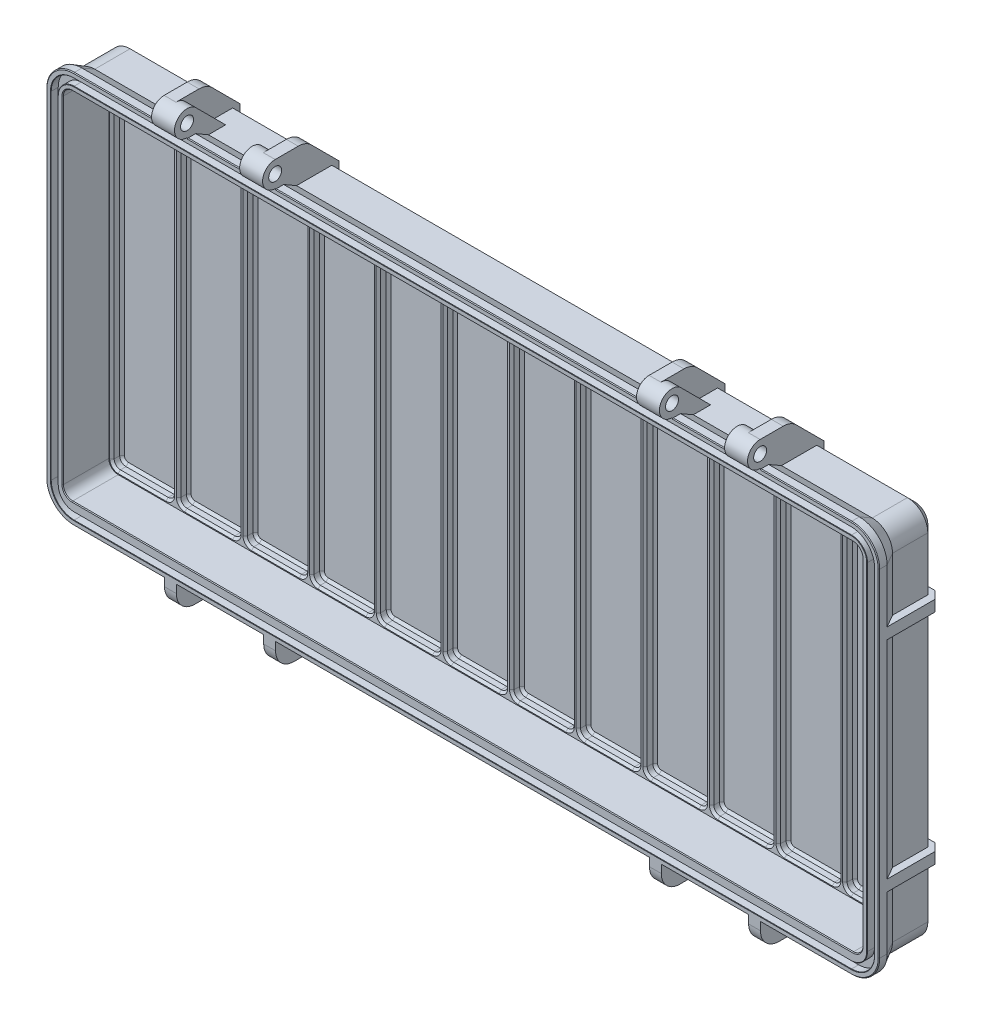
SolidWorks part; units mm, degrees
ref_plane "Front Plane" through (0, 0, 0) normal (0, 0, 1) x (1, 0, 0)
ref_plane "Top Plane" through (0, 0, 0) normal (0, 1, 0) x (1, 0, 0)
ref_plane "Right Plane" through (0, 0, 0) normal (1, 0, 0) x (0, 0, -1)
ref_plane "Bottom plane" through (0, 0, -2) normal (0, 0, 1) x (1, 0, 0)
sketch "Sketch1" plane through (0, 0, 0) normal (0, 0, 1) x (1, 0, 0)
  line L1 (-9, 48) -> (9, 48)
  line L2 (-9, 48) -> (-9, -48)
  line L3 (-9, -48) -> (9, -48)
  line L4 (9, 48) -> (9, -48)
  line L5 (-9, 48) -> (9, -48) construction
  line L6 (-9, -48) -> (9, 48) construction
  point P0 (0, 0)
  dimension "D1" = 18
  dimension "D2" = 96
extrude "Boss-Extrude1" add sketch "Sketch1" along normal blind 2.75
sketch "Sketch2" plane through (0, 0, 0) normal (0, 0, 1) x (1, 0, 0)
  line L1 (-6.45, 46.5) -> (6.45, 46.5)
  line L2 (-7.5, 45.45) -> (-7.5, -45.45)
  line L3 (-6.45, -46.5) -> (6.45, -46.5)
  line L4 (7.5, 45.45) -> (7.5, -45.45)
  line L5 (-7.5, 46.5) -> (7.5, -46.5) construction
  line L6 (-7.5, -46.5) -> (7.5, 46.5) construction
  arc A0 (-7.5, -45.45) -> (-6.45, -46.5) centre (-6.45, -45.45) ccw
  arc A1 (6.45, -46.5) -> (7.5, -45.45) centre (6.45, -45.45) ccw
  arc A2 (6.45, 46.5) -> (7.5, 45.45) centre (6.45, 45.45) cw
  arc A3 (-6.45, 46.5) -> (-7.5, 45.45) centre (-6.45, 45.45) ccw
  point P0 (0, 0)
  dimension "D3" = 1.05
  dimension "D1" = 15
  dimension "D2" = 93
extrude "Cut-Extrude1" cut sketch "Sketch2" along normal blind 0.65 draft 45
sketch "Sketch4" plane through (0, 0, 0.65) normal (0, 0, -1) x (-1, 0, 0)
  line L4 (8.15, -45.45) -> (8.15, 45.45)
  line L5 (6.45, 47.15) -> (-6.45, 47.15)
  line L6 (-8.15, 45.45) -> (-8.15, -45.45)
  line L7 (-6.45, -47.15) -> (6.45, -47.15)
  line L8 (8.15, -45.45) -> (8.15, 45.45)
  line L9 (6.45, 47.15) -> (-6.45, 47.15)
  line L10 (-8.15, 45.45) -> (-8.15, -45.45)
  line L11 (-6.45, -47.15) -> (6.45, -47.15)
  arc A4 (6.45, -47.15) -> (8.15, -45.45) centre (6.45, -45.45) ccw
  arc A5 (8.15, 45.45) -> (6.45, 47.15) centre (6.45, 45.45) ccw
  arc A6 (-6.45, 47.15) -> (-8.15, 45.45) centre (-6.45, 45.45) ccw
  arc A7 (-8.15, -45.45) -> (-6.45, -47.15) centre (-6.45, -45.45) ccw
  arc A8 (6.45, -47.15) -> (8.15, -45.45) centre (6.45, -45.45) ccw
  arc A9 (8.15, 45.45) -> (6.45, 47.15) centre (6.45, 45.45) ccw
  arc A10 (-6.45, 47.15) -> (-8.15, 45.45) centre (-6.45, 45.45) ccw
  arc A11 (-8.15, -45.45) -> (-6.45, -47.15) centre (-6.45, -45.45) ccw
  dimension "D1" = 0
extrude "Cut-Extrude2" cut sketch "Sketch4" against normal blind 1.5
sketch "Sketch5" plane through (0, 0, 2.15) normal (0, 0, -1) x (-1, 0, 0)
  line L4 (8.15, -45.45) -> (8.15, 45.45)
  line L5 (6.45, 47.15) -> (-6.45, 47.15)
  line L6 (-8.15, 45.45) -> (-8.15, -45.45)
  line L7 (-6.45, -47.15) -> (6.45, -47.15)
  line L8 (8.15, -45.45) -> (8.15, 45.45)
  line L9 (6.45, 47.15) -> (-6.45, 47.15)
  line L10 (-8.15, 45.45) -> (-8.15, -45.45)
  line L11 (-6.45, -47.15) -> (6.45, -47.15)
  arc A4 (6.45, -47.15) -> (8.15, -45.45) centre (6.45, -45.45) ccw
  arc A5 (8.15, 45.45) -> (6.45, 47.15) centre (6.45, 45.45) ccw
  arc A6 (-6.45, 47.15) -> (-8.15, 45.45) centre (-6.45, 45.45) ccw
  arc A7 (-8.15, -45.45) -> (-6.45, -47.15) centre (-6.45, -45.45) ccw
  arc A8 (6.45, -47.15) -> (8.15, -45.45) centre (6.45, -45.45) ccw
  arc A9 (8.15, 45.45) -> (6.45, 47.15) centre (6.45, 45.45) ccw
  arc A10 (-6.45, 47.15) -> (-8.15, 45.45) centre (-6.45, 45.45) ccw
  arc A11 (-8.15, -45.45) -> (-6.45, -47.15) centre (-6.45, -45.45) ccw
  dimension "D1" = 0
extrude "Cut-Extrude3" cut sketch "Sketch5" against normal blind 0.85 draft 45
pattern_linear "LPattern1" count 12 spacing 18 along (1, 0, 0) of "Boss-Extrude1", "Cut-Extrude1", "Cut-Extrude2", "Cut-Extrude3"
sketch "Sketch6" plane through (0, 0, 0) normal (0, 0, -1) x (-1, 0, 0)
  line L2 (9, -51.5) -> (-207, -51.5)
  line L4 (6, -51.5) -> (-204, -51.5)
  line L8 (11.5, 50.5) -> (11.5, -48)
  line L9 (-209.5, -48) -> (-209.5, 50.5)
  line L10 (-209.5, 50.5) -> (11.5, 50.5)
  line L11 (11.5, 45) -> (11.5, -46)
  line L17 (-209.5, -46) -> (-209.5, 45)
  line L18 (-204, 50.5) -> (6, 50.5)
  arc A0 (11.5, 45) -> (6, 50.5) centre (6, 45) ccw
  arc A1 (6, -51.5) -> (11.5, -46) centre (6, -46) ccw
  arc A2 (-209.5, -46) -> (-204, -51.5) centre (-204, -46) ccw
  arc A3 (-209.5, 45) -> (-204, 50.5) centre (-204, 45) cw
  dimension "D2" = 3.5
  dimension "D3" = 5.5
  dimension "D1" = 2.5
extrude "Boss-Extrude3" add sketch "Sketch6" along normal blind 2 draft 45
sketch "Sketch9" plane through (0, 0, 0) normal (0, 0, 1) x (1, 0, 0)
  line L0 (209.5, 45) -> (209.5, -46) construction
  line L1 (204, -51.5) -> (-6, -51.5) construction
  line L2 (-11.5, -46) -> (-11.5, 45) construction
  line L3 (-6, 50.5) -> (204, 50.5) construction
  line L4 (209.5, 45) -> (209.5, -46)
  line L5 (204, -51.5) -> (-6, -51.5)
  line L6 (-11.5, -46) -> (-11.5, 45)
  line L7 (-6, 50.5) -> (204, 50.5)
  line L8 (-9, -48) -> (207, -48) construction
  line L9 (207, -48) -> (207, 48) construction
  line L10 (-9, 48) -> (-9, -48) construction
  line L11 (207, 48) -> (-9, 48) construction
  line L12 (-6.45, -48) -> (204.45, -48)
  line L13 (207, -45.45) -> (207, 45.45)
  line L14 (-9, 45.45) -> (-9, -45.45)
  line L15 (204.45, 48) -> (-6.45, 48)
  arc A0 (209.5, 45) -> (204, 50.5) centre (204, 45) ccw construction
  arc A1 (204, -51.5) -> (209.5, -46) centre (204, -46) ccw construction
  arc A2 (-11.5, -46) -> (-6, -51.5) centre (-6, -46) ccw construction
  arc A3 (-6, 50.5) -> (-11.5, 45) centre (-6, 45) ccw construction
  arc A4 (209.5, 45) -> (204, 50.5) centre (204, 45) ccw
  arc A5 (204, -51.5) -> (209.5, -46) centre (204, -46) ccw
  arc A6 (-11.5, -46) -> (-6, -51.5) centre (-6, -46) ccw
  arc A7 (-6, 50.5) -> (-11.5, 45) centre (-6, 45) ccw
  arc A8 (204.45, -48) -> (207, -45.45) centre (204.45, -45.45) ccw
  arc A9 (-6.45, -48) -> (-9, -45.45) centre (-6.45, -45.45) cw
  arc A10 (207, 45.45) -> (204.45, 48) centre (204.45, 45.45) ccw
  arc A11 (-9, 45.45) -> (-6.45, 48) centre (-6.45, 45.45) cw
  dimension "D1" = 2.55
extrude "Boss-Extrude5" add sketch "Sketch9" along normal blind 13
sketch "Sketch10" plane through (0, 0, 13) normal (0, 0, 1) x (1, 0, 0)
  line L5 (204, 52.5) -> (-6, 52.5)
  line L6 (-13.5, 45) -> (-13.5, -46)
  line L7 (-6, -53.5) -> (204, -53.5)
  line L16 (211.5, -46) -> (211.5, 45)
  line L18 (204.45, -48) -> (-6.45, -48) construction
  line L19 (207, -45.45) -> (207, 45.45) construction
  line L20 (-9, 45.45) -> (-9, -45.45) construction
  line L21 (204.45, 48) -> (-6.45, 48) construction
  line L22 (204.45, -48) -> (-6.45, -48)
  line L23 (207, -45.45) -> (207, 45.45)
  line L24 (-9, 45.45) -> (-9, -45.45)
  line L25 (204.45, 48) -> (-6.45, 48)
  arc A4 (-6, 52.5) -> (-13.5, 45) centre (-6, 45) ccw
  arc A5 (-13.5, -46) -> (-6, -53.5) centre (-6, -46) ccw
  arc A6 (204, -53.5) -> (211.5, -46) centre (204, -46) ccw
  arc A7 (211.5, 45) -> (204, 52.5) centre (204, 45) ccw
  arc A16 (-9, -45.45) -> (-6.45, -48) centre (-6.45, -45.45) ccw construction
  arc A17 (204.45, -48) -> (207, -45.45) centre (204.45, -45.45) ccw construction
  arc A18 (207, 45.45) -> (204.45, 48) centre (204.45, 45.45) ccw construction
  arc A19 (-6.45, 48) -> (-9, 45.45) centre (-6.45, 45.45) ccw construction
  arc A20 (-9, -45.45) -> (-6.45, -48) centre (-6.45, -45.45) ccw
  arc A21 (204.45, -48) -> (207, -45.45) centre (204.45, -45.45) ccw
  arc A22 (207, 45.45) -> (204.45, 48) centre (204.45, 45.45) ccw
  arc A23 (-6.45, 48) -> (-9, 45.45) centre (-6.45, 45.45) ccw
extrude "Boss-Extrude6" add sketch "Sketch10" against normal blind 4 draft 30
sketch "Sketch11" plane through (0, 0, 13) normal (0, 0, 1) x (1, 0, 0)
  line L0 (-6.45, -48) -> (204.45, -48) construction
  line L1 (207, -45.45) -> (207, 45.45) construction
  line L2 (-9, 45.45) -> (-9, -45.45) construction
  line L3 (-6.45, 48) -> (204.45, 48) construction
  line L4 (204, 52.5) -> (-6, 52.5)
  line L5 (-13.5, 45) -> (-13.5, -46)
  line L6 (-6, -53.5) -> (204, -53.5)
  line L7 (211.5, -46) -> (211.5, 45)
  line L8 (204, 52.5) -> (-6, 52.5)
  line L9 (-13.5, 45) -> (-13.5, -46)
  line L10 (-6, -53.5) -> (204, -53.5)
  line L11 (211.5, -46) -> (211.5, 45)
  line L12 (-6.45, -48) -> (204.45, -48)
  line L13 (207, -45.45) -> (207, 45.45)
  line L14 (-9, 45.45) -> (-9, -45.45)
  line L15 (-6.45, 48) -> (204.45, 48)
  arc A0 (-9, -45.45) -> (-6.45, -48) centre (-6.45, -45.45) ccw construction
  arc A1 (204.45, -48) -> (207, -45.45) centre (204.45, -45.45) ccw construction
  arc A2 (207, 45.45) -> (204.45, 48) centre (204.45, 45.45) ccw construction
  arc A3 (-6.45, 48) -> (-9, 45.45) centre (-6.45, 45.45) ccw construction
  arc A4 (211.5, 45) -> (204, 52.5) centre (204, 45) ccw
  arc A5 (-6, 52.5) -> (-13.5, 45) centre (-6, 45) ccw
  arc A6 (-13.5, -46) -> (-6, -53.5) centre (-6, -46) ccw
  arc A7 (204, -53.5) -> (211.5, -46) centre (204, -46) ccw
  arc A8 (211.5, 45) -> (204, 52.5) centre (204, 45) ccw
  arc A9 (-6, 52.5) -> (-13.5, 45) centre (-6, 45) ccw
  arc A10 (-13.5, -46) -> (-6, -53.5) centre (-6, -46) ccw
  arc A11 (204, -53.5) -> (211.5, -46) centre (204, -46) ccw
  arc A12 (-9, -45.45) -> (-6.45, -48) centre (-6.45, -45.45) ccw
  arc A13 (204.45, -48) -> (207, -45.45) centre (204.45, -45.45) ccw
  arc A14 (207, 45.45) -> (204.45, 48) centre (204.45, 45.45) ccw
  arc A15 (-6.45, 48) -> (-9, 45.45) centre (-6.45, 45.45) ccw
  dimension "D1" = 0
extrude "Boss-Extrude7" add sketch "Sketch11" along normal blind 2.2
sketch "Sketch12" plane through (0, 0, 15.2) normal (0, 0, 1) x (1, 0, 0)
  line L28 (208.3, -46) -> (208.3, 45)
  line L29 (204, 49.3) -> (-6, 49.3)
  line L30 (-10.3, 45) -> (-10.3, -46)
  line L31 (-6, -50.3) -> (204, -50.3)
  line L32 (210.2, -46) -> (210.2, 45)
  line L33 (-6, -52.2) -> (204, -52.2)
  line L34 (-12.2, 45) -> (-12.2, -46)
  line L35 (204, 51.2) -> (-6, 51.2)
  line L36 (210.2, -46) -> (210.2, 45)
  line L37 (-6, -52.2) -> (204, -52.2)
  line L38 (-12.2, 45) -> (-12.2, -46)
  line L39 (204, 51.2) -> (-6, 51.2)
  line L40 (-9, 45.45) -> (-9, -45.45) construction
  arc A24 (208.3, 45) -> (204, 49.3) centre (204, 45) ccw
  arc A25 (-6, 49.3) -> (-10.3, 45) centre (-6, 45) ccw
  arc A26 (-10.3, -46) -> (-6, -50.3) centre (-6, -46) ccw
  arc A27 (204, -50.3) -> (208.3, -46) centre (204, -46) ccw
  arc A28 (210.2, 45) -> (204, 51.2) centre (204, 45) ccw
  arc A29 (204, -52.2) -> (210.2, -46) centre (204, -46) ccw
  arc A30 (-12.2, -46) -> (-6, -52.2) centre (-6, -46) ccw
  arc A31 (-6, 51.2) -> (-12.2, 45) centre (-6, 45) ccw
  arc A32 (210.2, 45) -> (204, 51.2) centre (204, 45) ccw
  arc A33 (204, -52.2) -> (210.2, -46) centre (204, -46) ccw
  arc A34 (-12.2, -46) -> (-6, -52.2) centre (-6, -46) ccw
  arc A35 (-6, 51.2) -> (-12.2, 45) centre (-6, 45) ccw
  dimension "D3" = 1.3
  dimension "D1" = 1.3
  dimension "D2" = 1.9
extrude "Cut-Extrude4" cut sketch "Sketch12" against normal blind 2
chamfer "Chamfer1" distance 0.2 16 edges at (207, 0, 15.2) (206.2531, 47.2531, 15.2) (206.2531, -47.2531, 15.2) (99, 48, 15.2) (99, -48, 15.2) (-8.2531, 47.2531, 15.2) (-8.2531, -47.2531, 15.2) (-9, 0, 15.2) (211.5, -0.5, 15.2) (209.3033, 50.3033, 15.2) (209.3033, -51.3033, 15.2) (99, 52.5, 15.2) (99, -53.5, 15.2) (-11.3033, 50.3033, 15.2) (-11.3033, -51.3033, 15.2) (-13.5, -0.5, 15.2)
chamfer "Chamfer2" distance 0.1 16 edges at (208.3, -0.5, 15.2) (207.0406, 48.0406, 15.2) (207.0406, -49.0406, 15.2) (99, 49.3, 15.2) (99, -50.3, 15.2) (-9.0406, 48.0406, 15.2) (-9.0406, -49.0406, 15.2) (-10.3, -0.5, 15.2) (210.2, -0.5, 15.2) (208.3841, 49.3841, 15.2) (208.3841, -50.3841, 15.2) (99, 51.2, 15.2) (99, -52.2, 15.2) (-10.3841, 49.3841, 15.2) (-10.3841, -50.3841, 15.2) (-12.2, -0.5, 15.2)
ref_plane "Plane 30mm" through (18.5, 0, 0) normal (-1, 0, 0) x (0, 0, 1)
ref_plane "Plane 45mm" through (33.5, 0, 0) normal (-1, 0, 0) x (0, 0, 1)
ref_plane "Plane 110.5mm" through (99, 0, 0) normal (-1, 0, 0) x (0, 0, 1)
sketch "Sketch14" plane through (18.5, 0, 0) normal (-1, 0, 0) x (0, 0, 1)
  line L0 (15, 52.5) -> (13, 52.5) construction
  line L2 (15.2, 45) -> (15.2, 52.3) construction
  line L3 (15.3, 52.7) -> (15.2, 52.6)
  line L4 (15, 52.5) -> (15.2, 52.3) construction
  line L5 (15, 52.5) -> (13, 52.5)
  line L6 (15, 52.5) -> (15.2, 52.3)
  line L7 (15.2, 52.3) -> (15.2, 52.6)
  line L8 (-2, 48.5) -> (0, 50.5) construction
  line L9 (9.5359, 50.5) -> (0, 50.5) construction
  line L10 (9.5359, 50.5) -> (13, 52.5) construction
  line L11 (-2, 48.5) -> (0, 50.5)
  line L12 (9.5359, 50.5) -> (0, 50.5)
  line L13 (9.5359, 50.5) -> (13, 52.5)
  line L14 (-2, 48.5) -> (-2, 50.5)
  line L15 (-2, 50.5) -> (5.5355, 58.0355)
  line L16 (9.0711, 59.5) -> (15.3, 59.5)
  arc A0 (15.3, 52.7) -> (15.3, 59.5) centre (15.3, 56.1) ccw
  circle A1 centre (15.3, 56.1) radius 1.75
  arc A2 (5.5355, 58.0355) -> (9.0711, 59.5) centre (9.0711, 54.5) cw
  dimension "D1" = 6.8
  dimension "D5" = 3.5
  dimension "D7" = 5
  dimension "D2" = 0.2
  dimension "D3" = 0.1
  dimension "D4" = 135
  dimension "D6" = 2
  dimension "D8" = 3.6
extrude "Boss-Extrude9" add sketch "Sketch14" against normal blind 3.2
sketch "Sketch15" plane through (21.7, 0, 0) normal (1, 0, 0) x (0, 0, -1)
  line L0 (-15.2, 52.6) -> (-15.3, 52.7) construction
  line L1 (-15.2, 52.3) -> (-15.2, 52.6) construction
  line L2 (-15, 52.5) -> (-15.2, 52.3) construction
  line L3 (-13, 52.5) -> (-15, 52.5) construction
  line L4 (0, 50.5) -> (-9.5359, 50.5) construction
  line L5 (-9.5359, 50.5) -> (-13, 52.5) construction
  line L6 (-15.2, 52.6) -> (-15.3, 52.7)
  line L7 (-15.2, 52.3) -> (-15.2, 52.6)
  line L8 (-15, 52.5) -> (-15.2, 52.3)
  line L9 (-13, 52.5) -> (-15, 52.5)
  line L10 (-4.8917, 50.5) -> (-9.5359, 50.5)
  line L11 (-9.5359, 50.5) -> (-13, 52.5)
  line L12 (-12.8958, 58.5042) -> (-4.8917, 50.5)
  line L14 (-5.5355, 58.0355) -> (2, 50.5) construction
  arc A0 (-15.3, 59.5) -> (-15.3, 52.7) centre (-15.3, 56.1) ccw construction
  arc A1 (-12.8958, 58.5042) -> (-15.3, 52.7) centre (-15.3, 56.1) ccw
  circle A2 centre (-15.3, 56.1) radius 1.75 construction
  circle A3 centre (-15.3, 56.1) radius 1.75
extrude "Boss-Extrude10" add sketch "Sketch15" along normal blind 3
mirror "Mirror1" about plane through (33.5, 0, 0) normal (-1, 0, 0) of "Boss-Extrude10", "Boss-Extrude9"
sketch "Sketch17" plane through (48.5, 0, 0) normal (1, 0, 0) x (0, 0, -1)
  circle A3 centre (-15.3, 56.1) radius 1.325
  circle A4 centre (-15.3, 56.1) radius 1.75 construction
  circle A5 centre (-15.3, 56.1) radius 1.75
  dimension "D1" = 2.65
extrude "Boss-Extrude11" [suppressed] add sketch "Sketch17" against normal up to surface (6.2 mm away)
mirror "Mirror2" about plane through (99, 0, 0) normal (-1, 0, 0) of "Boss-Extrude11", "Mirror1"
ref_plane "PlaneY 20mm" through (0, -31.5, 0) normal (0, -1, 0) x (-1, 0, 0)
sketch "Sketch18" plane through (0, -31.5, 0) normal (0, -1, 0) x (-1, 0, 0)
  line L0 (9.5, 2) -> (11.5, 0) construction
  line L1 (11.5, -9.5359) -> (11.5, 0) construction
  line L2 (11.5, -9.5359) -> (13.5, -13) construction
  line L3 (9.5, 2) -> (11.5, 0)
  line L4 (11.5, -9.5359) -> (11.5, 0)
  line L5 (11.5, -9.5359) -> (13.5, -13)
  line L6 (13.5, -13) -> (13.5, 0)
  line L7 (13.5, 0) -> (11.5, 2)
  line L8 (11.5, 2) -> (9.5, 2)
  line L10 (-207.5, 2) -> (-209.5, 0) construction
  line L11 (-209.5, -9.5359) -> (-209.5, 0) construction
  line L12 (-209.5, -9.5359) -> (-211.5, -13) construction
  line L13 (-207.5, 2) -> (-209.5, 0)
  line L14 (-209.5, -9.5359) -> (-209.5, 0)
  line L15 (-209.5, -9.5359) -> (-211.5, -13)
  line L16 (-211.5, -13) -> (-211.5, 0)
  line L17 (-211.5, 0) -> (-209.5, 2)
  line L18 (-209.5, 2) -> (-207.5, 2)
  dimension "D1" = 2
  dimension "D2" = 2
extrude "Boss-Extrude12" add sketch "Sketch18" against normal blind 3
pattern_linear "LPattern3" count 2 spacing 59 along (0, 1, 0) of "Boss-Extrude12"
sketch "Sketch19" plane through (18.5, 0, 0) normal (-1, 0, 0) x (0, 0, 1)
  line L0 (15.2, -53.3) -> (15.2, -55.5)
  line L1 (10.2, -60.5) -> (4.7711, -60.5)
  line L2 (-2, -49.5) -> (-2, -55.8)
  line L4 (15.2, -53.3) -> (15, -53.5) construction
  line L5 (15, -53.5) -> (13, -53.5) construction
  line L6 (9.5359, -51.5) -> (13, -53.5) construction
  line L7 (9.5359, -51.5) -> (0, -51.5) construction
  line L8 (-2, -49.5) -> (0, -51.5) construction
  line L9 (15.2, -53.3) -> (15, -53.5)
  line L10 (15, -53.5) -> (13, -53.5)
  line L11 (9.5359, -51.5) -> (13, -53.5)
  line L12 (9.5359, -51.5) -> (0, -51.5)
  line L13 (-2, -49.5) -> (0, -51.5)
  line L14 (-2, -55.8) -> (1.2355, -59.0355)
  arc A0 (15.2, -55.5) -> (10.2, -60.5) centre (10.2, -55.5) cw
  circle A2 centre (7.3, -55.8) radius 1.75
  arc A5 (4.7711, -60.5) -> (1.2355, -59.0355) centre (4.7711, -55.5) cw
  dimension "D3" = 5
  dimension "D5" = 3.5
  dimension "D1" = 5
  dimension "D2" = 7
  dimension "D6" = 7.9
  dimension "D7" = 2.3
extrude "Boss-Extrude13" add sketch "Sketch19" against normal blind 3.2
mirror "Mirror3" about plane through (33.5, 0, 0) normal (-1, 0, 0) of "Boss-Extrude13"
mirror "Mirror4" about plane through (99, 0, 0) normal (-1, 0, 0) of "Mirror3", "Boss-Extrude13"
sketch "Sketch20" plane through (-11.5, 0, 0) normal (-1, 0, 0) x (0, 0, 1)
  line L0 (2.5, 27.5) -> (2.5, -28.5) construction
  line L1 (0, 27.5) -> (9.5359, 27.5) construction
  line L2 (0, -28.5) -> (9.5359, -28.5) construction
  line L3 (0, -28.5) -> (0, 27.5) construction
  text T0 "1K0 - 9K9" font "Verdana" height 5
  dimension "D1" = 2.5
extrude "Marking" [suppressed] add sketch "Sketch20" along normal blind 0.2
